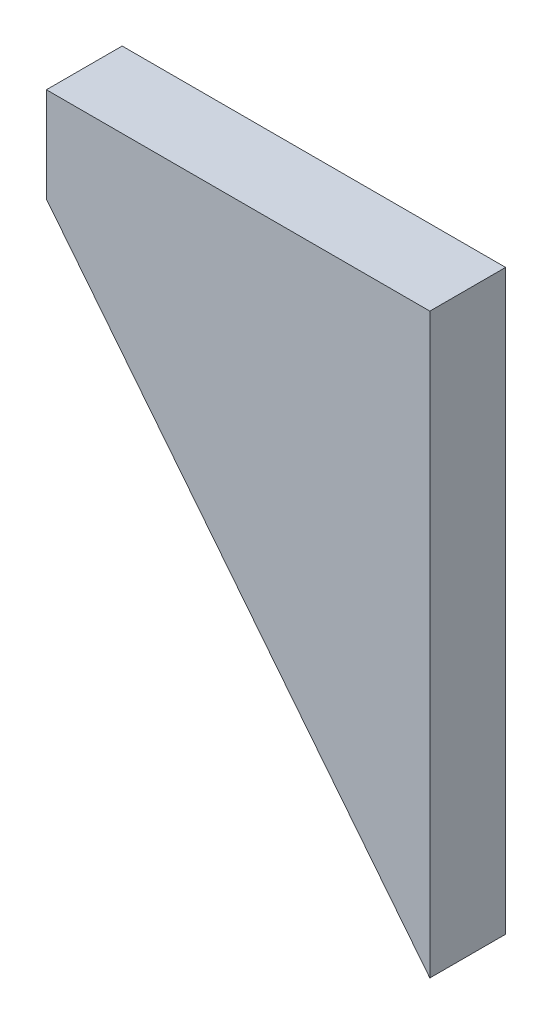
SolidWorks part; units mm, degrees
ref_plane "Plan de face" through (0, 0, 0) normal (0, 0, 1) x (1, 0, 0)
ref_plane "Plan de dessus" through (0, 0, 0) normal (0, 1, 0) x (1, 0, 0)
ref_plane "Plan de droite" through (0, 0, 0) normal (1, 0, 0) x (0, 0, -1)
sketch "Esquisse1" plane through (0, 0, 0) normal (0, 0, 1) x (1, 0, 0)
  line L0 (0, 0) -> (0, 10)
  line L1 (0, 10) -> (40.5, 10)
  line L2 (40.5, 10) -> (40.5, -51)
  line L3 (40.5, -51) -> (0, 0)
  dimension "D1" = 40.5
  dimension "D2" = 10
  dimension "D3" = 61
extrude "Extrusion1" add sketch "Esquisse1" along normal blind 8
